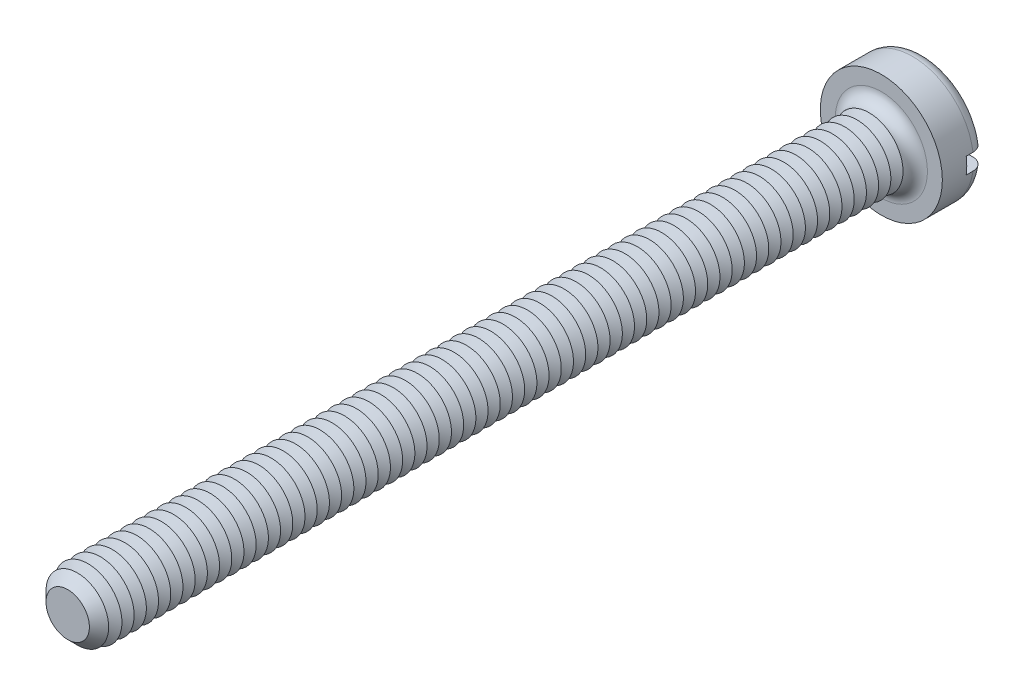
SolidWorks part; units mm, degrees
ref_plane "Front Plane" through (0, 0, 0) normal (0, 0, 1) x (1, 0, 0)
ref_plane "Top Plane" through (0, 0, 0) normal (0, 1, 0) x (1, 0, 0)
ref_plane "Right Plane" through (0, 0, 0) normal (1, 0, 0) x (0, 0, -1)
sketch "Sketch3" plane through (0, 0, 0) normal (0, 0, 1) x (1, 0, 0)
  circle A0 centre (0, 0) radius 2.25
  dimension "D1" = 4.5
extrude "Boss-Extrude2" add sketch "Sketch3" against normal blind 1.6
sketch "Sketch4" plane through (0, 0, 0) normal (0, 0, 1) x (1, 0, 0)
  circle A0 centre (0, 0) radius 1.25
  dimension "D1" = 2.5
extrude "Boss-Extrude3" add sketch "Sketch4" along normal blind 30
fillet "Fillet1" radius 0.45 2 edges at (2.25, 0, -1.6) (1.25, 0, 0)
chamfer "Chamfer1" distance 0.45 angle 45 1 edges at (1.25, 0, 30)
sketch "Sketch5" plane through (0, 0, 0) normal (1, 0, 0) x (0, 0, -1)
  line L0 (1.6944, 0) -> (-7.6738, 0) construction
sketch "Sketch6" plane through (0, 0, 0) normal (1, 0, 0) x (0, 0, -1)
  line L0 (-0.45, 1.25) -> (-0.675, 0.8603)
  line L1 (-0.675, 0.8603) -> (-0.9, 1.25)
  line L2 (-0.45, 1.25) -> (-29.55, 1.25) construction
  line L3 (-0.9, 1.25) -> (-0.45, 1.25)
  dimension "D1" = 0.45
revolve "Cut-Revolve1" cut sketch "Sketch6" angle 360 about L0
pattern_linear "LPattern1" count 65 spacing 0.45 along (0, 0, 1) of "Cut-Revolve1"
sketch "Sketch8" plane through (0, 0, -1.6) normal (0, 0, -1) x (-1, 0, 0)
  line L1 (2.25, -0.3) -> (-2.25, -0.3)
  line L2 (2.25, -0.3) -> (2.25, 0.3)
  line L3 (2.25, 0.3) -> (-2.25, 0.3)
  line L4 (-2.25, -0.3) -> (-2.25, 0.3)
  line L5 (2.25, -0.3) -> (-2.25, 0.3) construction
  line L6 (2.25, 0.3) -> (-2.25, -0.3) construction
  point P0 (0, 0)
  dimension "D1" = 4.5
  dimension "D2" = 0.6
extrude "Cut-Extrude1" cut sketch "Sketch8" against normal blind 0.7
